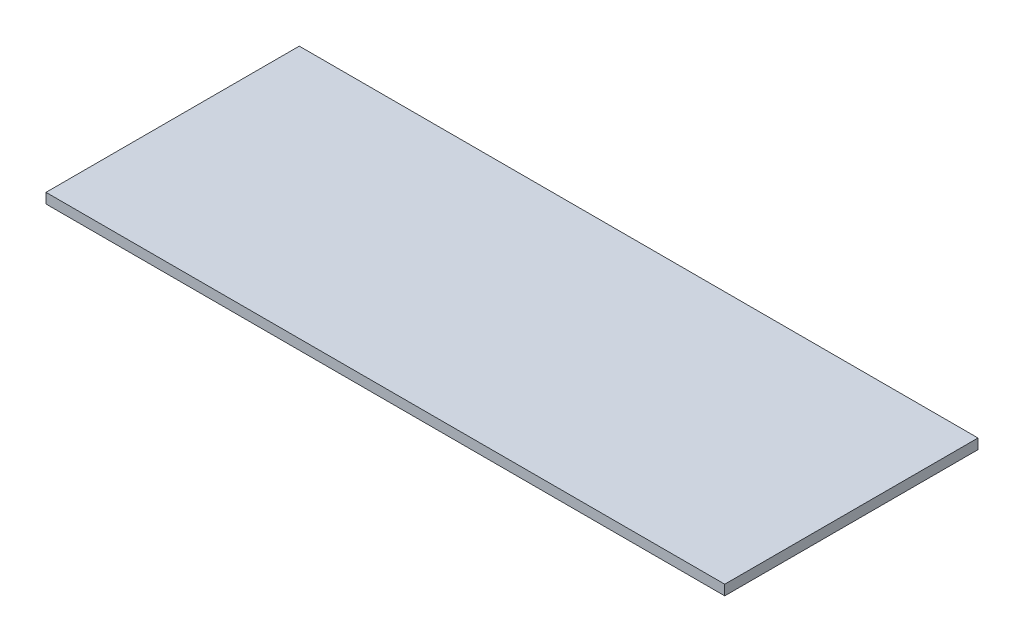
SolidWorks part; units mm, degrees
ref_plane "Front Plane" through (0, 0, 0) normal (0, 0, 1) x (1, 0, 0)
ref_plane "Top Plane" through (0, 0, 0) normal (0, 1, 0) x (1, 0, 0)
ref_plane "Right Plane" through (0, 0, 0) normal (1, 0, 0) x (0, 0, -1)
sketch "Sketch1" plane through (0, 0, 0) normal (0, 1, 0) x (1, 0, 0)
  line L1 (-67, 25) -> (67, 25)
  line L2 (-67, 25) -> (-67, -25)
  line L3 (-67, -25) -> (67, -25)
  line L4 (67, 25) -> (67, -25)
  line L5 (-67, 25) -> (67, -25) construction
  line L6 (-67, -25) -> (67, 25) construction
  point P0 (0, 0)
  dimension "D1" = 50
  dimension "D2" = 134
extrude "Boss-Extrude1" add sketch "Sketch1" along normal blind 2
